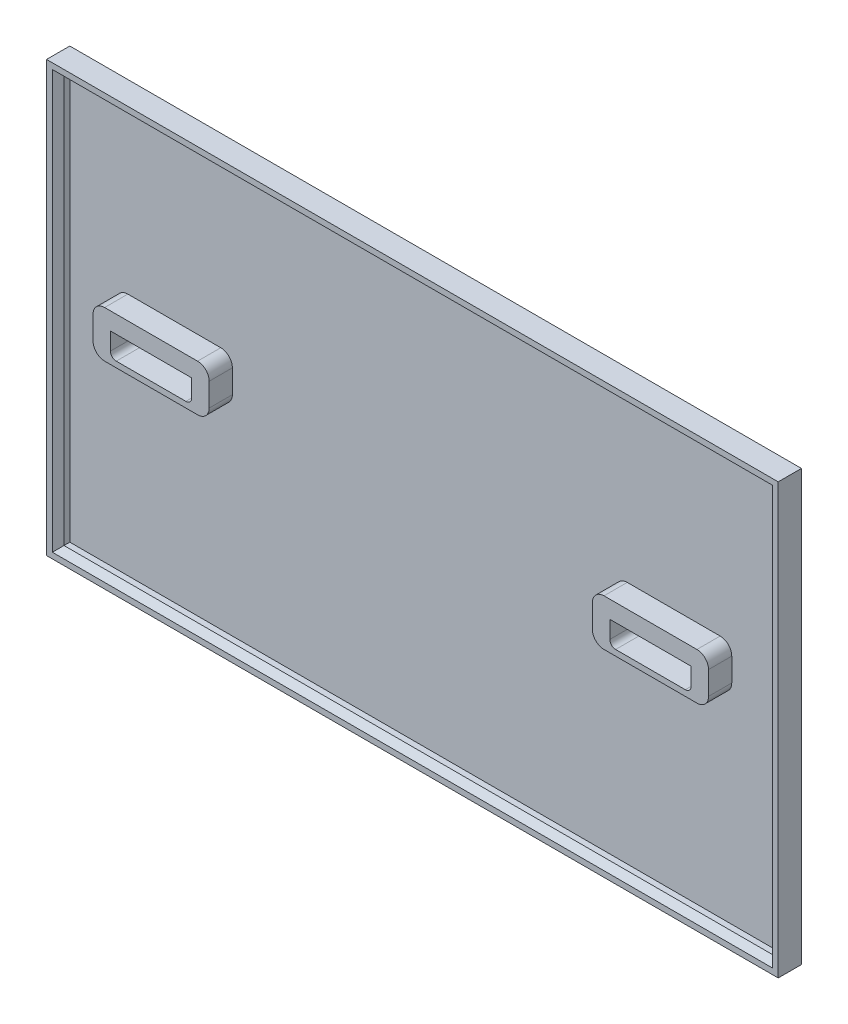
SolidWorks part; units mm, degrees
ref_plane "前基準面" through (0, 0, 0) normal (0, 0, 1) x (1, 0, 0)
ref_plane "上基準面" through (0, 0, 0) normal (0, 1, 0) x (1, 0, 0)
ref_plane "右基準面" through (0, 0, 0) normal (1, 0, 0) x (0, 0, -1)
sketch "草圖1" plane through (0, 0, 0) normal (0, 0, 1) x (1, 0, 0)
  line L1 (0, 0) -> (630, 0)
  line L2 (0, 0) -> (0, -370)
  line L3 (0, -370) -> (630, -370)
  line L4 (630, 0) -> (630, -370)
  dimension "D1" = 630
  dimension "D2" = 370
extrude "填料-伸長1" add sketch "草圖1" along normal blind 20
shell "薄殼2" thickness 10
shell "薄殼4" thickness 10
chamfer "導角1" distance 5 angle 45 4 edges at (315, -360, 20) (620, -185, 20) (10, -185, 20) (315, -10, 20)
sketch "草圖2" plane through (0, 0, 10) normal (0, 0, 1) x (1, 0, 0)
  line L0 (0, 0) -> (0, -370) construction
  line L1 (60, -150) -> (140, -150)
  line L2 (50, -160) -> (50, -180)
  line L3 (60, -190) -> (140, -190)
  line L4 (150, -160) -> (150, -180)
  line L5 (490, -150) -> (570, -150)
  line L6 (480, -160) -> (480, -180)
  line L7 (490, -190) -> (570, -190)
  line L8 (580, -160) -> (580, -180)
  line L9 (630, 0) -> (0, 0) construction
  line L10 (630, -370) -> (630, 0) construction
  line L11 (630, 0) -> (0, 0) construction
  arc A0 (150, -180) -> (140, -190) centre (140, -180) cw
  arc A1 (150, -160) -> (140, -150) centre (140, -160) ccw
  arc A2 (50, -180) -> (60, -190) centre (60, -180) ccw
  arc A3 (60, -150) -> (50, -160) centre (60, -160) ccw
  arc A4 (580, -180) -> (570, -190) centre (570, -180) cw
  arc A5 (580, -160) -> (570, -150) centre (570, -160) ccw
  arc A6 (480, -180) -> (490, -190) centre (490, -180) ccw
  arc A7 (480, -160) -> (490, -150) centre (490, -160) cw
  point P16 (150, -150)
  point P19 (50, -190)
  point P22 (50, -150)
  point P27 (580, -150)
  point P30 (480, -190)
  point P33 (480, -150)
  dimension "D8" = 10
  dimension "D9" = 10
  dimension "D1" = 100
  dimension "D2" = 100
  dimension "D3" = 40
  dimension "D4" = 40
  dimension "D5" = 50
  dimension "D6" = 50
  dimension "D7" = 150
  dimension "D10" = 150
extrude "填料-伸長2" add sketch "草圖2" along normal blind 20
sketch "草圖3" plane through (0, 0, 30) normal (0, 0, 1) x (1, 0, 0)
  line L0 (50, -160) -> (50, -180) construction
  line L1 (65, -165) -> (135, -165)
  line L2 (65, -165) -> (65, -180)
  line L3 (70, -185) -> (130, -185)
  line L4 (135, -165) -> (135, -180)
  line L5 (495, -165) -> (565, -165)
  line L6 (495, -165) -> (495, -180)
  line L7 (500, -185) -> (560, -185)
  line L8 (565, -165) -> (565, -180)
  line L9 (480, -160) -> (480, -180) construction
  line L10 (140, -150) -> (60, -150) construction
  line L11 (570, -150) -> (490, -150) construction
  arc A0 (565, -180) -> (560, -185) centre (560, -180) cw
  arc A1 (495, -180) -> (500, -185) centre (500, -180) ccw
  arc A2 (135, -180) -> (130, -185) centre (130, -180) cw
  arc A3 (65, -180) -> (70, -185) centre (70, -180) ccw
  point P21 (495, -185)
  point P26 (65, -185)
  dimension "D9" = 5
  dimension "D1" = 70
  dimension "D2" = 70
  dimension "D3" = 20
  dimension "D4" = 20
  dimension "D5" = 15
  dimension "D6" = 15
  dimension "D7" = 15
  dimension "D8" = 15
extrude "除料-伸長1" cut sketch "草圖3" against normal blind 20
